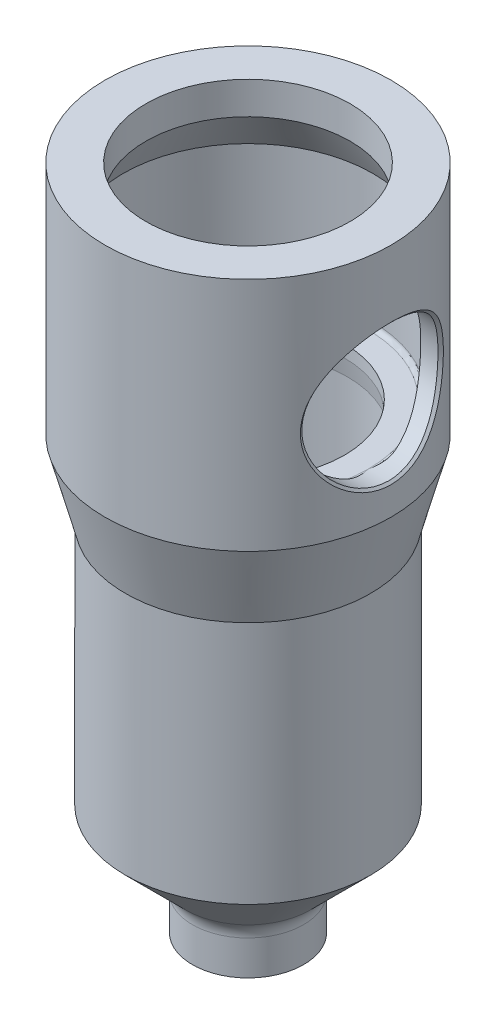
SolidWorks part; units mm, degrees
ref_plane "Ebene vorne" through (0, 0, 0) normal (0, 0, 1) x (1, 0, 0)
ref_plane "Ebene oben" through (0, 0, 0) normal (0, 1, 0) x (1, 0, 0)
ref_plane "Ebene rechts" through (0, 0, 0) normal (1, 0, 0) x (0, 0, -1)
sketch "Skizze14" plane through (0, 0, 0) normal (0, 0, 1) x (1, 0, 0)
  line L0 (0, -215.4594) -> (0, 1702.8782) construction
  line L1 (0, 1469) -> (-315, 1469)
  line L2 (-315, 1469) -> (-315, 949.9423)
  line L3 (-315, 949.9423) -> (-270, 782)
  line L4 (-270, 782) -> (-270, 244.5)
  line L5 (-122.5, 0) -> (0, 0)
  line L6 (0, 0) -> (0, 1469)
  line L7 (-122.5, 0) -> (-122.5, 97)
  line L8 (-122.5, 97) -> (-270, 244.5)
  dimension "D1" = 540
  dimension "D2" = 630
  dimension "D3" = 1469
  dimension "D4" = 782
  dimension "D5" = 15
  dimension "D6" = 245
  dimension "D7" = 97
  dimension "D8" = 45
revolve "Aussenkontur" add sketch "Skizze14" angle 360 about L0
sketch "Skizze10" plane through (0, 0, 0) normal (0, 0, 1) x (1, 0, 0)
  line L0 (0, -115.8659) -> (0, 1535.8282) construction
  line L1 (-78, 264) -> (-212.5, 264)
  line L2 (-212.5, 264) -> (-212.5, 296.5)
  line L3 (-212.5, 296.5) -> (-219.5, 336.199)
  line L4 (-219.5, 336.199) -> (-219.5, 950.301)
  line L5 (-219.5, 950.301) -> (-212.5, 990)
  line L7 (-78, 199.1147) -> (-92.5, 145)
  line L8 (-212.5, 1017) -> (-275, 1017)
  line L9 (-275, 1017) -> (-275, 1310.8975)
  line L10 (315, 1469) -> (-315, 1469) construction
  line L13 (-225, 1469) -> (0, 1469)
  line L14 (0, 1469) -> (0, 0)
  line L16 (-92.5, 145) -> (-92.5, 0)
  line L18 (-92.5, 0) -> (0, 0)
  line L19 (-78, 264) -> (-78, 199.1147)
  line L22 (-212.5, 990) -> (-212.5, 1017)
  line L23 (-275, 1310.8975) -> (-225, 1397.5)
  line L27 (-225, 1397.5) -> (-225, 1469)
  dimension "D2" = 550
  dimension "D3" = 425
  dimension "D4" = 439
  dimension "D5" = 425
  dimension "D6" = 32.5
  dimension "D7" = 156
  dimension "D8" = 10
  dimension "D9" = 10
  dimension "D10" = 452
  dimension "D11" = 27
  dimension "D12" = 753
  dimension "D14" = 185
  dimension "D15" = 15
  dimension "D16" = 145
  dimension "D18" = 71.5
  dimension "D19" = 450
  dimension "D20" = 30
revolve "Innenkontur" cut sketch "Skizze10" angle 360 about L0
fillet "Verrundung1" radius 10 1 edges at (0, 1017, -275)
sketch "Skizze15" plane through (0, 0, 0) normal (1, 0, 0) x (0, 0, -1)
  line L0 (0, -42.4979) -> (0, 1517.4609) construction
  line L1 (315, 1469) -> (-315, 1469) construction
  circle A0 centre (0, 1167) radius 150
  dimension "D1" = 300
  dimension "D2" = 302
extrude "Schnitt-Linear austragen1" cut sketch "Skizze15" along normal through all
chamfer "Fase1" distance 5 angle 45 1 edges at (314.5509, 1316.0547, 16.8138)
fillet "Verrundung2" radius 50 1 edges at (0, 97, -122.5)
